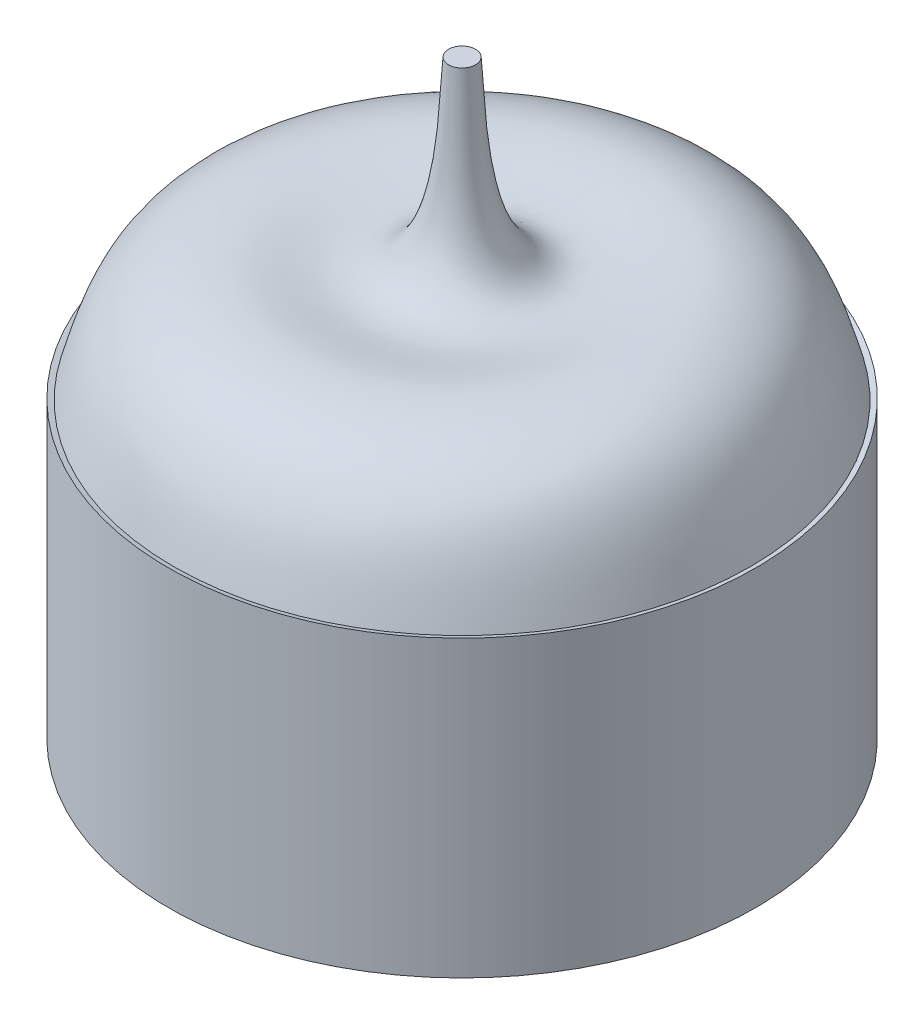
SolidWorks part; units mm, degrees
ref_plane "Ebene vorne" through (0, 0, 0) normal (0, 0, 1) x (1, 0, 0)
ref_plane "Ebene oben" through (0, 0, 0) normal (0, 1, 0) x (1, 0, 0)
ref_plane "Ebene rechts" through (0, 0, 0) normal (1, 0, 0) x (0, 0, -1)
sketch "Skizze1" plane through (0, 0, 0) normal (0, 1, 0) x (1, 0, 0)
  circle A0 centre (0, 0) radius 54.8363 construction
  circle A1 centre (0, 0) radius 54.8363
extrude "Linear austragen3" add sketch "Skizze1" along normal up to body
